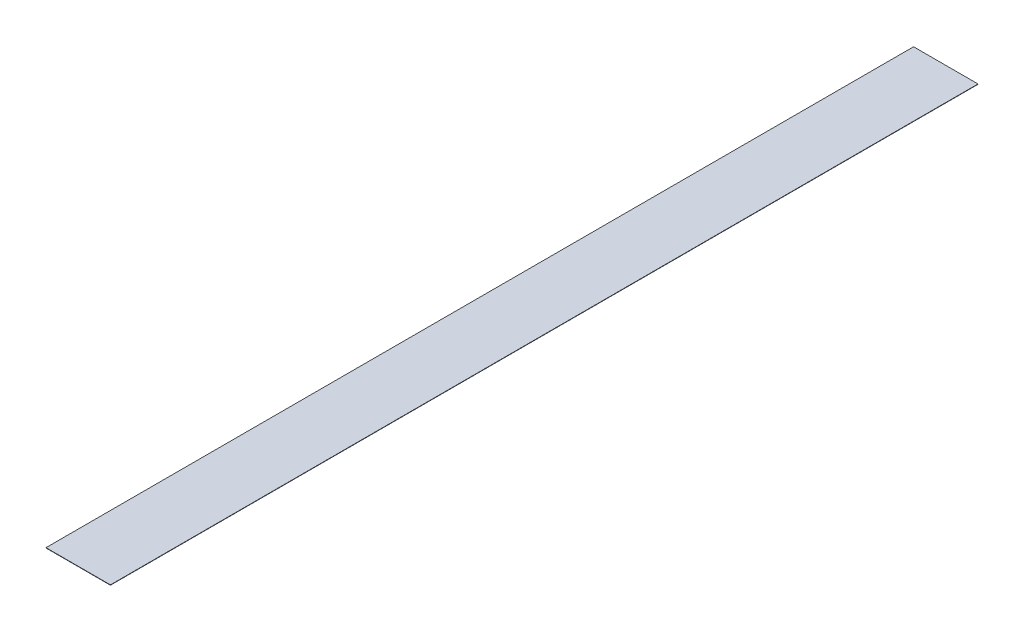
SolidWorks part; units mm, degrees
ref_plane "Front Plane" through (0, 0, 0) normal (0, 0, 1) x (1, 0, 0)
ref_plane "Top Plane" through (0, 0, 0) normal (0, 1, 0) x (1, 0, 0)
ref_plane "Right Plane" through (0, 0, 0) normal (1, 0, 0) x (0, 0, -1)
sketch "Sketch1" plane through (0, 0, 0) normal (0, 1, 0) x (1, 0, 0)
  line L0 (-55, 0) -> (55, 0) construction
  line L1 (0, -55) -> (0, 55) construction
  line L5 (23.8125, -320.675) -> (-23.8125, -320.675)
  line L6 (23.8125, -320.675) -> (23.8125, 320.675)
  line L7 (23.8125, 320.675) -> (-23.8125, 320.675)
  line L8 (-23.8125, -320.675) -> (-23.8125, 320.675)
  point P2 (23.8125, 0)
  point P9 (0, -320.675)
  dimension "D1" = 641.35
  dimension "D2" = 47.625
extrude "Boss-Extrude1" add sketch "Sketch1" along normal blind 0.254
